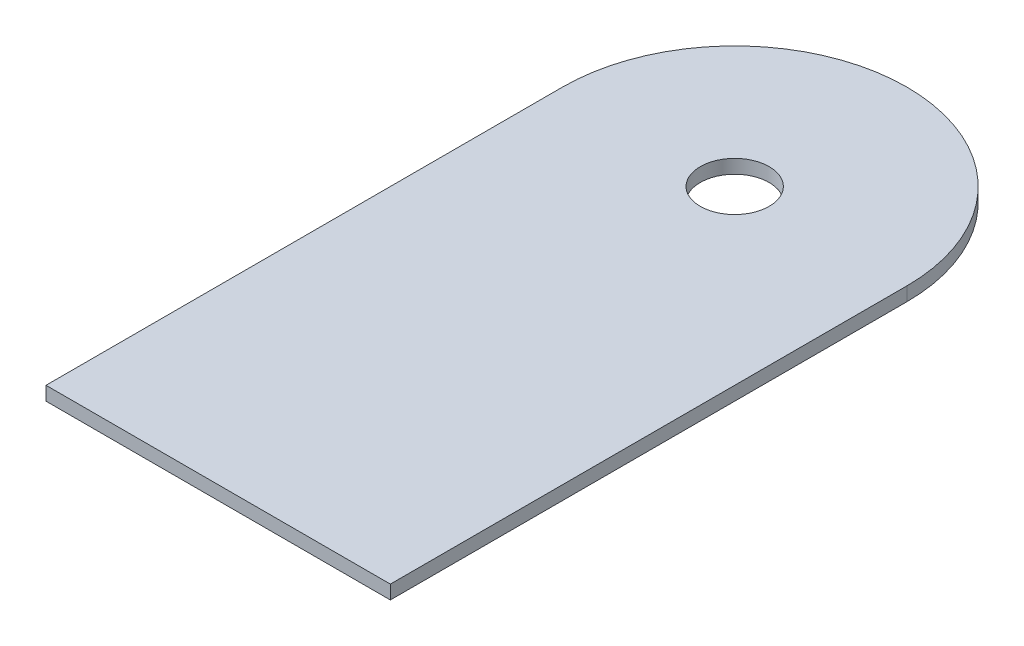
SolidWorks part; units mm, degrees
ref_plane "Front Plane" through (0, 0, 0) normal (0, 0, 1) x (1, 0, 0)
ref_plane "Top Plane" through (0, 0, 0) normal (0, 1, 0) x (1, 0, 0)
ref_plane "Right Plane" through (0, 0, 0) normal (1, 0, 0) x (0, 0, -1)
sketch "Sketch2" plane through (0, 0, 0) normal (0, 1, 0) x (1, 0, 0)
  line L0 (-43.75, 0) -> (43.75, 0) construction
  line L1 (25, 0) -> (25, -75)
  line L2 (25, -75) -> (-25, -75)
  line L3 (-25, -75) -> (-25, 0)
  circle A0 centre (0, 0) radius 5
  arc A1 (25, 0) -> (-25, 0) centre (0, 0) ccw
  point P7 (0, 0)
  dimension "D1" = 10
  dimension "D2" = 50
  dimension "D3" = 75
  dimension "D4" = 50
extrude "Boss-Extrude1" add sketch "Sketch2" along normal blind 2
